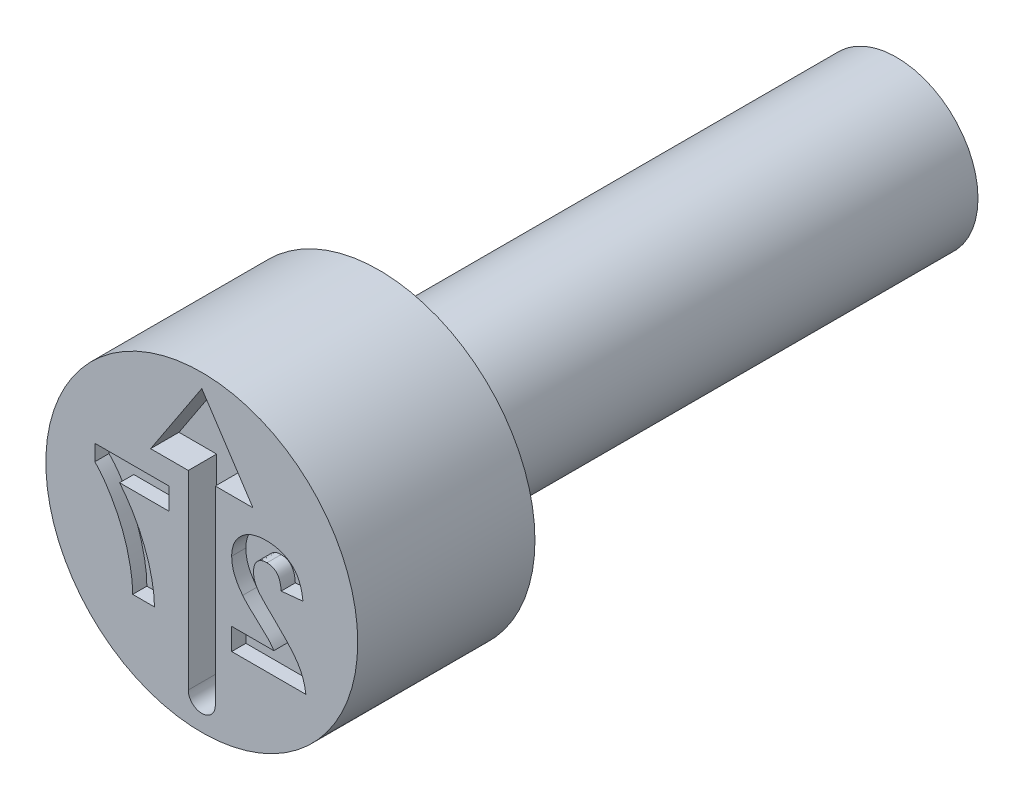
SolidWorks part; units mm, degrees
ref_plane "Front Plane" through (0, 0, 0) normal (0, 0, 1) x (1, 0, 0)
ref_plane "Top Plane" through (0, 0, 0) normal (0, 1, 0) x (1, 0, 0)
ref_plane "Right Plane" through (0, 0, 0) normal (1, 0, 0) x (0, 0, -1)
sketch "Sketch2" plane through (0, 0, 0) normal (1, 0, 0) x (0, 0, -1)
  line L0 (0.4039, 0) -> (50000.4039, 0) construction
  line L6 (0, 2.2) -> (0, 0)
  line L7 (2.5, 2.2) -> (0, 2.2)
  line L8 (2.5, 1.15) -> (2.5, 2.2)
  line L9 (9.8, 1.15) -> (2.5, 1.15)
  line L10 (9.8, 0) -> (9.8, 1.15)
  line L11 (0, 0) -> (9.8, 0)
  dimension "D1" = 4.4
  dimension "D2" = 2.3
  dimension "D3" = 9.8
  dimension "D4" = 2.5
revolve "Revolve1" add sketch "Sketch2" angle 360 about L0
sketch "Sketch3" plane through (0, 0, 0) normal (0, 0, 1) x (1, 0, 0)
  line L0 (0, 0) -> (0, 100000) construction
  line L1 (0.1905, 0.9064) -> (0.1905, -1.7762)
  line L2 (0.7219, 0.9064) -> (0.1905, 0.9064)
  line L3 (0, 2.0021) -> (0.7219, 0.9064)
  line L15 (0, 2.0021) -> (-0.7219, 0.9064)
  line L16 (-0.7219, 0.9064) -> (-0.1905, 0.9064)
  line L17 (-0.1905, 0.9064) -> (-0.1905, -1.7762)
  arc A2 (-0.1905, -1.7762) -> (0.1905, -1.7762) centre (0, -1.7762) ccw
extrude "Cut-Extrude4" cut sketch "Sketch3" against normal blind 0.4
sketch "Sketch4" plane through (0, 0, 0) normal (0, 0, 1) x (1, 0, 0)
  text T0 "2  7" font "Arial" height 1.6
  dimension "D1" = 1
  dimension "D2" = 1.55
extrude "Cut-Extrude5" cut sketch "Sketch4" against normal blind 0.2
